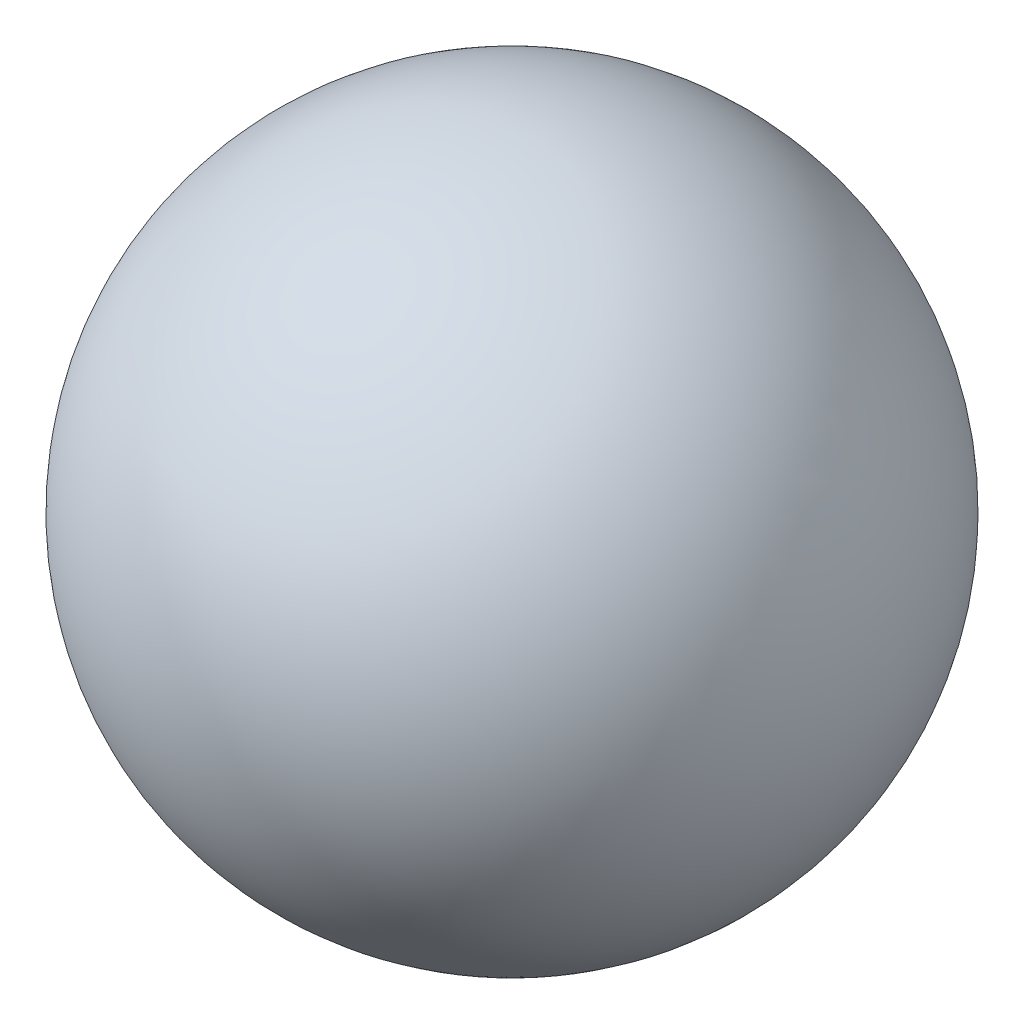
SolidWorks part; units mm, degrees
ref_plane "Front Plane" through (0, 0, 0) normal (0, 0, 1) x (1, 0, 0)
ref_plane "Top Plane" through (0, 0, 0) normal (0, 1, 0) x (1, 0, 0)
ref_plane "Right Plane" through (0, 0, 0) normal (1, 0, 0) x (0, 0, -1)
sketch "Sketch1" plane through (0, 0, 0) normal (0, 0, 1) x (1, 0, 0)
  line L0 (0, 0) -> (0, 112.9816)
  line L1 (0, 112.9816) -> (0, -120.4055)
  line L2 (0, -3.7119) -> (0, 765.8613)
  line L3 (0, 765.8613) -> (0, -780.7113)
  circle A0 centre (0, 0) radius 192.3
  circle A1 centre (0, 0) radius 202.3
  dimension "D1" = 10
  dimension "D2" = 384.6
revolve "Revolve1" add sketch "Sketch1" angle 360 about L3
sketch "Sketch2" plane through (0, 0, 0) normal (0, 1, 0) x (1, 0, 0)
  circle A0 centre (0, 0) radius 21.1733
extrude "Cut-Extrude1" cut sketch "Sketch2" against normal through all
